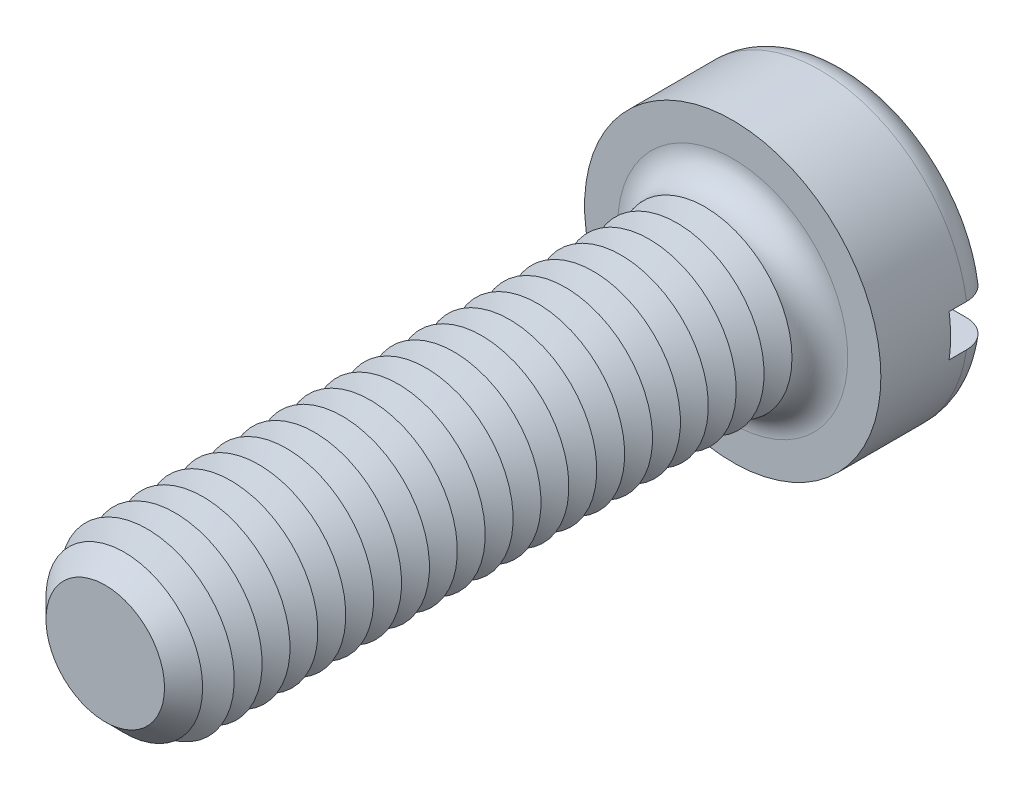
SolidWorks part; units mm, degrees
ref_plane "Front Plane" through (0, 0, 0) normal (0, 0, 1) x (1, 0, 0)
ref_plane "Top Plane" through (0, 0, 0) normal (0, 1, 0) x (1, 0, 0)
ref_plane "Right Plane" through (0, 0, 0) normal (1, 0, 0) x (0, 0, -1)
sketch "Sketch3" plane through (0, 0, 0) normal (0, 0, 1) x (1, 0, 0)
  circle A0 centre (0, 0) radius 4.25
  dimension "D1" = 8.5
extrude "Boss-Extrude2" add sketch "Sketch3" against normal blind 3.3
sketch "Sketch4" plane through (0, 0, 0) normal (0, 0, 1) x (1, 0, 0)
  circle A0 centre (0, 0) radius 2.5
  dimension "D1" = 5
extrude "Boss-Extrude3" add sketch "Sketch4" along normal blind 18
fillet "Fillet1" radius 0.8 2 edges at (4.25, 0, -3.3) (2.5, 0, 0)
chamfer "Chamfer1" distance 0.8 angle 45 1 edges at (2.5, 0, 18)
sketch "Sketch5" plane through (0, 0, 0) normal (1, 0, 0) x (0, 0, -1)
  line L0 (1.6944, 0) -> (-7.6738, 0) construction
sketch "Sketch6" plane through (0, 0, 0) normal (1, 0, 0) x (0, 0, -1)
  line L0 (-0.8, 2.5) -> (-1.2, 1.8072)
  line L1 (-1.2, 1.8072) -> (-1.6, 2.5)
  line L2 (-0.8, 2.5) -> (-17.2, 2.5) construction
  line L3 (-1.6, 2.5) -> (-0.8, 2.5)
  dimension "D1" = 0.8
revolve "Cut-Revolve1" cut sketch "Sketch6" angle 360 about L0
pattern_linear "LPattern1" count 21 spacing 0.8 along (0, 0, 1) of "Cut-Revolve1"
sketch "Sketch8" plane through (0, 0, -3.3) normal (0, 0, -1) x (-1, 0, 0)
  line L1 (4.25, -0.6) -> (-4.25, -0.6)
  line L2 (4.25, -0.6) -> (4.25, 0.6)
  line L3 (4.25, 0.6) -> (-4.25, 0.6)
  line L4 (-4.25, -0.6) -> (-4.25, 0.6)
  line L5 (4.25, -0.6) -> (-4.25, 0.6) construction
  line L6 (4.25, 0.6) -> (-4.25, -0.6) construction
  point P0 (0, 0)
  dimension "D1" = 8.5
  dimension "D2" = 1.2
extrude "Cut-Extrude1" cut sketch "Sketch8" against normal blind 1.3
